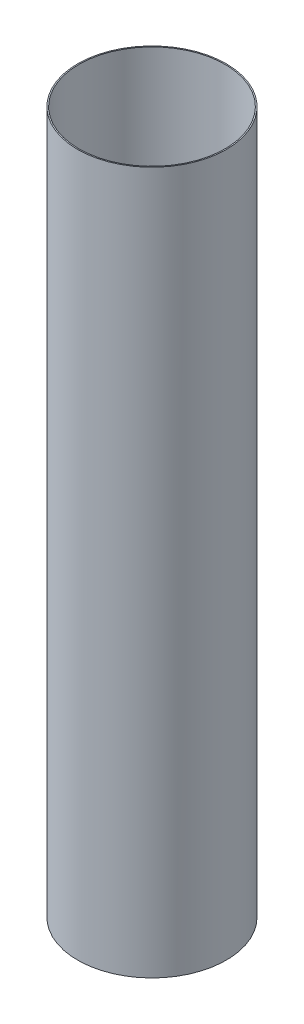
SolidWorks part; units mm, degrees
ref_plane "Front Plane" through (0, 0, 0) normal (0, 0, 1) x (1, 0, 0)
ref_plane "Top Plane" through (0, 0, 0) normal (0, 1, 0) x (1, 0, 0)
ref_plane "Right Plane" through (0, 0, 0) normal (1, 0, 0) x (0, 0, -1)
sketch "Sketch2" plane through (0, 0, 0) normal (0, 1, 0) x (1, 0, 0)
  circle A0 centre (0, 0) radius 158.75
  dimension "D1" = 317.5
extrude "Extrude-Thin1" add sketch "Sketch2" along normal blind 1524 thin
sketch3d "3DSketch1" plane through (0, 0, 0) normal (0, 0, 1) x (1, 0, 0)
  dimension "D1" = 2.54
sketch3d "3DSketch3" plane through (0, 0, 0) normal (0, 0, 1) x (1, 0, 0)
sketch "Sketch4" plane through (-161.29, 0, 0) normal (-1, 0, 0) x (0, 0, 1)
  line L0 (2.54, 25.4) -> (2.54, 0)
  line L1 (2.54, 25.4) -> (-2.54, 25.4)
  line L2 (2.54, 0) -> (-2.54, 0)
  line L3 (-2.54, 25.4) -> (-2.54, 0)
  line L4 (2.54, 25.4) -> (-2.54, 0) construction
  line L5 (2.54, 0) -> (-2.54, 25.4) construction
  line L6 (-161.29, 0) -> (161.29, 0) construction
  point P1 (0, 12.7)
  point P3 (0, 0)
  dimension "D1" = 25.4
  dimension "D2" = 5.08
extrude "Cut-Extrude2" cut sketch "Sketch4" against normal blind 8.128 contours L0 L2 L3 L1
